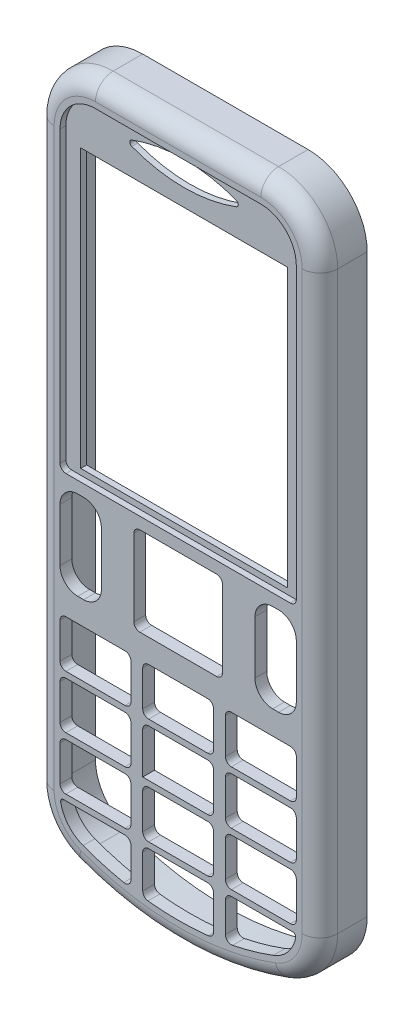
SolidWorks part; units mm, degrees
ref_plane "Ebene vorne" through (0, 0, 0) normal (0, 0, 1) x (1, 0, 0)
ref_plane "Ebene oben" through (0, 0, 0) normal (0, 1, 0) x (1, 0, 0)
ref_plane "Ebene rechts" through (0, 0, 0) normal (1, 0, 0) x (0, 0, -1)
sketch "Skizze1" plane through (0, 0, 0) normal (0, 0, 1) x (1, 0, 0)
  line L0 (0, -55) -> (0, 55) construction
  line L1 (0, -93.5303) -> (0, 100.4268) construction
  line L2 (-24, -53.8634) -> (-24, 60)
  line L3 (-24, 60) -> (24, 60)
  line L4 (24, -53.8634) -> (24, 60)
  line L5 (-58.8767, 0) -> (60.6097, 0) construction
  line L6 (55, 0) -> (-55, 0) construction
  arc A0 (-24, -53.8634) -> (24, -53.8634) centre (0, -10) ccw
  point P14 (0, -60)
  dimension "D2" = 60
  dimension "D4" = 50
  dimension "D1" = 60
  dimension "D3" = 48
extrude "Aufsatz-Linear austragen1" add sketch "Skizze1" against normal blind 8
fillet "Verrundung1" radius 10 4 edges at (-24, -53.8634, -4) (24, -53.8634, -4) (-24, 60, -4) (24, 60, -4)
fillet "Verrundung2" radius 3 8 edges at (-21.0711, 57.0711, 0) (0, 60, 0) (21.0711, 57.0711, 0) (24, 1.265, 0) (22.2158, -53.1709, 0) (0, -60, 0) (-22.2158, -53.1709, 0) (-24, 1.265, 0)
shell "Schale1" thickness 2
sketch "Skizze2" plane through (0, 0, 0) normal (0, 0, 1) x (1, 0, 0)
  line L0 (55, 0) -> (-55, 0) construction
  line L1 (-17.5, 1) -> (17.5, 1)
  line L2 (-17.5, 1) -> (-17.5, 48)
  line L3 (-17.5, 48) -> (17.5, 48)
  line L4 (17.5, 1) -> (17.5, 48)
  line L5 (0, -9.0165) -> (0, 63.7509) construction
  arc A1 (-10, 53) -> (10, 53) centre (0, 75.9129) ccw
  arc A3 (10, 53) -> (-10, 53) centre (0, 30.0871) ccw
  dimension "D4" = 25
  dimension "D5" = 25
  dimension "D1" = 35
  dimension "D2" = 47
  dimension "D3" = 1
  dimension "D6" = 53
  dimension "D7" = 20
extrude "Schnitt-Linear austragen1" cut sketch "Skizze2" against normal up to surface (2 mm away)
fillet "Verrundung3" radius 0.5 2 edges at (10, 53, -1) (-10, 53, -1)
sketch "Skizze3" plane through (0, 0, 0) normal (0, 0, 1) x (1, 0, 0)
  line L10 (-20, 0) -> (20, 0)
  line L13 (20, -47.47) -> (20, 50)
  line L14 (-20, 50) -> (-20, -47.47)
  line L15 (14, 56) -> (-14, 56)
  line L16 (20, 0) -> (20, 50)
  line L17 (-20, 50) -> (-20, 0)
  line L18 (14, 56) -> (-14, 56)
  arc A7 (20, 50) -> (14, 56) centre (14, 50) ccw
  arc A8 (-14, 56) -> (-20, 50) centre (-14, 50) ccw
  arc A9 (20, 50) -> (14, 56) centre (14, 50) ccw
  arc A10 (-14, 56) -> (-20, 50) centre (-14, 50) ccw
  dimension "D1" = 1
extrude "Schnitt-Linear austragen2" cut sketch "Skizze3" against normal blind 1
fillet "Verrundung4" radius 1 2 edges at (20, 0, -0.5) (-20, 0, -0.5)
sketch "Skizze4" plane through (0, 0, 0) normal (0, 0, 1) x (1, 0, 0)
  line L2 (20, -47.47) -> (20, 50)
  line L3 (20, -47) -> (20, -39)
  line L4 (8, -47) -> (8, -39)
  line L5 (-20, 50) -> (-20, -47.47)
  line L6 (-20, -21) -> (-20, -29)
  line L7 (4.4, 0) -> (-4.4, 0) construction
  line L8 (0, -56) -> (0, 10.5075) construction
  line L9 (-19.9765, -48) -> (-8, -48)
  line L10 (-20, -47) -> (-8, -47)
  line L11 (-20, -39) -> (-8, -39)
  line L12 (-20, -38) -> (-8, -38)
  line L13 (-20, -30) -> (-8, -30)
  line L14 (-20, -29) -> (-8, -29)
  line L15 (-20, -21) -> (-8, -21)
  line L16 (-6, -55.607) -> (-6, -48)
  line L17 (6, -55.607) -> (6, -48)
  line L18 (-8, -55.299) -> (-8, -48)
  line L19 (8, -55.299) -> (8, -48)
  line L20 (8, -21) -> (20, -21)
  line L21 (-6, -21) -> (6, -21)
  line L22 (-6, -29) -> (6, -29)
  line L23 (-6, -30) -> (6, -30)
  line L24 (-6, -38) -> (6, -38)
  line L25 (-6, -39) -> (6, -39)
  line L26 (-6, -47) -> (6, -47)
  line L27 (-6, -48) -> (6, -48)
  line L28 (8, -48) -> (19.9765, -48)
  line L29 (8, -47) -> (20, -47)
  line L30 (8, -39) -> (20, -39)
  line L31 (8, -30) -> (20, -30)
  line L32 (8, -29) -> (20, -29)
  line L33 (8, -38) -> (20, -38)
  line L34 (-8, -47) -> (-8, -39)
  line L35 (-6, -47) -> (-6, -39)
  line L36 (-20, -39) -> (-20, -47)
  line L37 (-20, -30) -> (-20, -38)
  line L38 (-6, -29) -> (-6, -21)
  line L39 (-8, -29) -> (-8, -21)
  line L40 (-8, -38) -> (-8, -30)
  line L41 (-6, -38) -> (-6, -30)
  line L42 (6, -38) -> (6, -30)
  line L43 (8, -38) -> (8, -30)
  line L44 (8, -29) -> (8, -21)
  line L45 (6, -29) -> (6, -21)
  line L46 (20, -29) -> (20, -21)
  line L47 (20, -38) -> (20, -30)
  line L48 (6, -47) -> (6, -39)
  arc A9 (-6, -55.607) -> (6, -55.607) centre (0, -10) ccw
  arc A10 (8, -55.299) -> (16.1, -53.0905) centre (0, -10) ccw
  arc A11 (-19.9765, -48) -> (-16.1, -53.0905) centre (-14, -47.47) ccw
  arc A12 (16.1, -53.0905) -> (20, -47.47) centre (14, -47.47) ccw
  arc A13 (-16.1, -53.0905) -> (16.1, -53.0905) centre (0, -10) ccw
  arc A14 (-20, -47.47) -> (-16.1, -53.0905) centre (-14, -47.47) ccw
  arc A15 (16.1, -53.0905) -> (19.9765, -48) centre (14, -47.47) ccw
  arc A16 (-16.1, -53.0905) -> (-8, -55.299) centre (0, -10) ccw
  arc A17 (-19.9765, -48) -> (-16.1, -53.0905) centre (-14, -47.47) ccw
  arc A19 (16.1, -53.0905) -> (19.9765, -48) centre (14, -47.47) ccw
  dimension "D4" = 1
  dimension "D5" = 8
  dimension "D6" = 1
  dimension "D7" = 8
  dimension "D8" = 1
  dimension "D9" = 8
  dimension "D10" = 12
  dimension "D11" = 2
  dimension "D12" = 2
  dimension "D13" = 21
  dimension "D1" = 1
  dimension "D2" = 1
extrude "Schnitt-Linear austragen3" cut sketch "Skizze4" against normal up to surface (2 mm away) and the other way through all
fillet "Verrundung5" radius 1 43 edges at (6, -47, -1) (-6, -47, -1) (20, -38, -1) (8, -38, -1) (6, -38, -1) (8, -21, -1) (8, -48, -1) (8, -30, -1) (20, -30, -1) (20, -21, -1) (6, -21, -1) (-6, -21, -1) (-6, -30, -1) (6, -30, -1) (6, -39, -1) (-6, -39, -1) (-6, -55.607, -1) (-6, -48, -1) (6, -48, -1) (6, -55.607, -1) (-8, -48, -1) (-8, -47, -1) (-8, -39, -1) (-20, -39, -1) (-20, -38, -1) (-20, -30, -1) (-8, -30, -1) (-8, -38, -1) (-8, -29, -1) (-20, -29, -1) (-20, -21, -1) (-8, -21, -1) (20, -29, -1) (6, -29, -1) (-6, -29, -1) (8, -29, -1) (8, -39, -1) (20, -39, -1) (20, -47, -1) (8, -47, -1) (-20, -47, -1)
fillet "Verrundung6" radius 0.5 2 edges
sketch "Skizze5" plane through (0, 0, 0) normal (0, 0, 1) x (1, 0, 0)
  line L0 (0, -18.8875) -> (0, 2.999) construction
  line L1 (-20, -2) -> (-13, -2)
  line L2 (-20, -2) -> (-20, -17)
  line L3 (-20, -17) -> (-13, -17)
  line L4 (-13, -2) -> (-13, -17)
  line L5 (13, -17) -> (20, -17)
  line L6 (13, -17) -> (13, -2)
  line L7 (13, -2) -> (20, -2)
  line L8 (20, -17) -> (20, -2)
  line L9 (-7.5, -17) -> (7.5, -17)
  line L10 (-7.5, -17) -> (-7.5, -2)
  line L11 (-7.5, -2) -> (7.5, -2)
  line L12 (7.5, -17) -> (7.5, -2)
  line L13 (0, -4.4) -> (0, 4.4) construction
  line L14 (21, -47.47) -> (21, 50) construction
  line L15 (-21, 50) -> (-21, -47.47) construction
  line L16 (4.4, 0) -> (-4.4, 0) construction
  point P23 (16.5, -17)
  dimension "D1" = 15
  dimension "D2" = 15
  dimension "D3" = 1
  dimension "D4" = 15
  dimension "D5" = 1
  dimension "D6" = 7
  dimension "D7" = 7
  dimension "D8" = 2
  dimension "D9" = 15
  dimension "D10" = 2
  dimension "D11" = 2
extrude "Schnitt-Linear austragen4" cut sketch "Skizze5" against normal up to surface (2 mm away)
fillet "Verrundung7" radius 1 4 edges at (-7.5, -17, -1) (7.5, -17, -1) (7.5, -2, -1) (-7.5, -2, -1)
fillet "Verrundung8" radius 3 8 edges at (20, -2, -1) (13, -2, -1) (13, -17, -1) (20, -17, -1) (-13, -17, -1) (-20, -17, -1) (-20, -2, -1) (-13, -2, -1)
ref_plane "E oben" through (0, 0, 20) normal (0, 0, 1) x (1, 0, 0)
ref_plane "E unten" through (0, 0, -28) normal (0, 0, 1) x (1, 0, 0)
sketch "Sk Kühlung o" plane through (0, 0, 20) normal (0, 0, 1) x (1, 0, 0)
  line L0 (-45.5074, 0) -> (29.4926, 0) construction
  line L1 (0, -65.0558) -> (0, 71.8622) construction
  line L2 (37.5, 60) -> (-37.5, 60)
  line L3 (-37.5, 60) -> (-37.5, 30)
  line L4 (-37.5, 30) -> (37.5, 30)
  line L5 (37.5, 30) -> (37.5, 0)
  line L6 (37.5, 0) -> (-37.5, 0)
  line L7 (-37.5, 0) -> (-37.5, -30)
  line L8 (-37.5, -30) -> (37.5, -30)
  line L9 (37.5, -30) -> (37.5, -60)
  line L10 (37.5, -60) -> (-37.5, -60)
  dimension "D1" = 75
  dimension "D2" = 30
  dimension "D3" = 30
  dimension "D4" = 30
  dimension "D5" = 30
  dimension "D6" = 0
  dimension "D7" = 0
sketch "Sk Kühlung u" plane through (0, 0, -28) normal (0, 0, 1) x (1, 0, 0)
  line L0 (37.5, -60) -> (-37.5, -60) construction
  line L1 (37.5, -30) -> (37.5, -60) construction
  line L2 (-37.5, -30) -> (37.5, -30) construction
  line L3 (-37.5, 0) -> (-37.5, -30) construction
  line L4 (37.5, 60) -> (-37.5, 60) construction
  line L5 (-37.5, 60) -> (-37.5, 30) construction
  line L6 (-37.5, 30) -> (37.5, 30) construction
  line L7 (37.5, 30) -> (37.5, 0) construction
  line L8 (37.5, 0) -> (-37.5, 0) construction
  line L9 (37.5, -60) -> (-37.5, -60)
  line L10 (37.5, -30) -> (37.5, -60)
  line L11 (-37.5, -30) -> (37.5, -30)
  line L12 (-37.5, 0) -> (-37.5, -30)
  line L13 (37.5, 60) -> (-37.5, 60)
  line L14 (-37.5, 60) -> (-37.5, 30)
  line L15 (-37.5, 30) -> (37.5, 30)
  line L16 (37.5, 30) -> (37.5, 0)
  line L17 (37.5, 0) -> (-37.5, 0)
